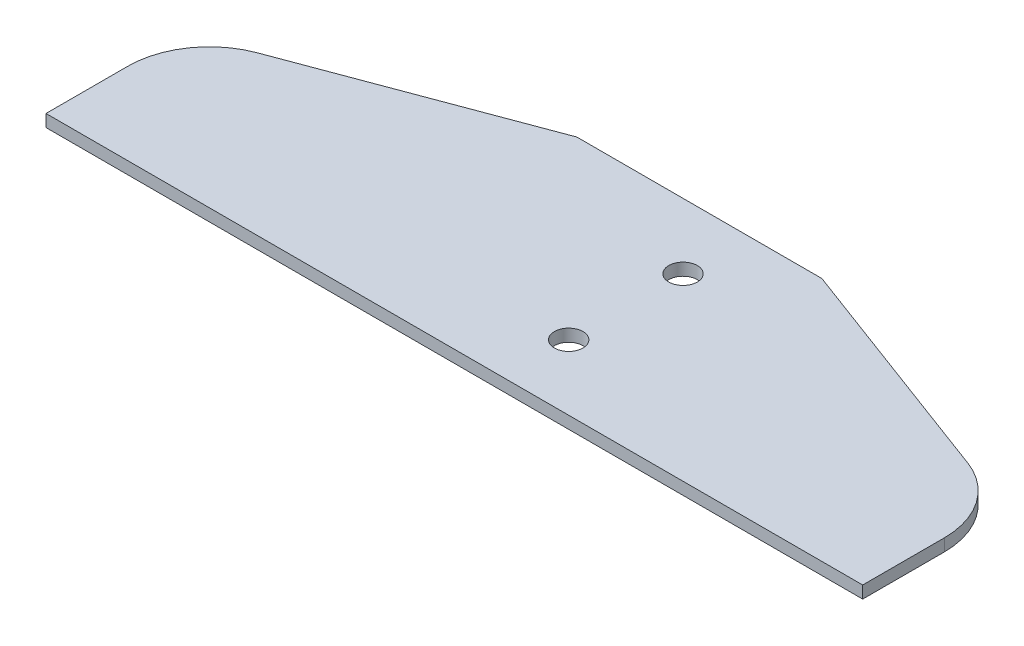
SolidWorks part; units mm, degrees
ref_plane "Front" through (0, 0, 0) normal (0, 0, 1) x (1, 0, 0)
ref_plane "Top" through (0, 0, 0) normal (0, 1, 0) x (1, 0, 0)
ref_plane "Right" through (0, 0, 0) normal (1, 0, 0) x (0, 0, -1)
sketch "Sketch1" plane through (0, 0, 0) normal (0, 1, 0) x (1, 0, 0)
  line L1 (-50, 0) -> (50, 0)
  line L2 (50, 0) -> (50, 10)
  line L3 (-15, 30) -> (15, 30)
  line L4 (-15, 30) -> (-43.4954, 19.3692)
  line L5 (-50, 0) -> (-50, 10)
  line L9 (15, 30) -> (43.4954, 19.3692)
  arc A0 (50, 10) -> (43.4954, 19.3692) centre (40, 10) ccw
  circle A1 centre (6, 8) radius 1.75
  circle A2 centre (6, 22) radius 1.75
  arc A3 (-50, 10) -> (-43.4954, 19.3692) centre (-40, 10) cw
extrude "Extrude1" add sketch "Sketch1" along normal blind 1.5
